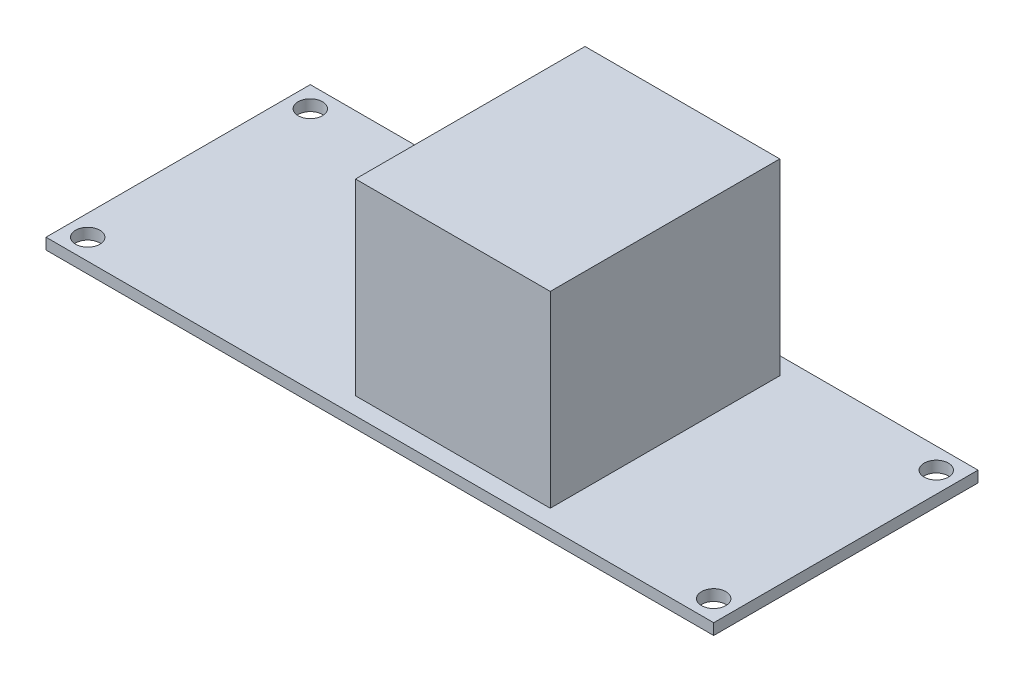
SolidWorks part; units mm, degrees
ref_plane "Спереди" through (0, 0, 0) normal (0, 0, 1) x (1, 0, 0)
ref_plane "Сверху" through (0, 0, 0) normal (0, 1, 0) x (1, 0, 0)
ref_plane "Справа" through (0, 0, 0) normal (1, 0, 0) x (0, 0, -1)
sketch "Эскиз1" plane through (0, 0, 0) normal (0, 1, 0) x (1, 0, 0)
  line L1 (-48, 19) -> (48, 19)
  line L2 (-48, 19) -> (-48, -19)
  line L3 (-48, -19) -> (48, -19)
  line L4 (48, 19) -> (48, -19)
  line L5 (-48, 19) -> (48, -19) construction
  line L6 (-48, -19) -> (48, 19) construction
  line L8 (-45, -16) -> (45, -16) construction
  line L9 (-45, -16) -> (-45, 16) construction
  line L10 (-45, 16) -> (45, 16) construction
  line L11 (45, -16) -> (45, 16) construction
  line L12 (-45, -16) -> (45, 16) construction
  line L13 (-45, 16) -> (45, -16) construction
  circle A0 centre (-45, 16) radius 1.75
  circle A1 centre (-45, -16) radius 1.75
  circle A2 centre (45, -16) radius 1.75
  circle A3 centre (45, 16) radius 1.75
  point P0 (0, 0)
  point P7 (0, 0)
  dimension "D5" = 3.5
  dimension "D1" = 38
  dimension "D2" = 96
  dimension "D3" = 32
  dimension "D4" = 90
extrude "Бобышка-Вытянуть1" add sketch "Эскиз1" along normal blind 1.6
sketch "Эскиз2" plane through (0, 1.6, 0) normal (0, 1, 0) x (1, 0, 0)
  line L0 (-48, 0) -> (48, 0) construction
  line L1 (-48, 19) -> (-48, -19) construction
  line L2 (48, -19) -> (48, 19) construction
  line L3 (8, 19) -> (8, -19) construction
  line L4 (48, 19) -> (-48, 19) construction
  line L5 (-48, -19) -> (48, -19) construction
  line L7 (-6, 16.5) -> (22, 16.5)
  line L8 (-6, 16.5) -> (-6, -16.5)
  line L9 (-6, -16.5) -> (22, -16.5)
  line L10 (22, 16.5) -> (22, -16.5)
  line L11 (-6, 16.5) -> (22, -16.5) construction
  line L12 (-6, -16.5) -> (22, 16.5) construction
  point P12 (8, 0)
  dimension "D1" = 56
  dimension "D2" = 28
  dimension "D3" = 33
extrude "Бобышка-Вытянуть2" add sketch "Эскиз2" along normal blind 27
